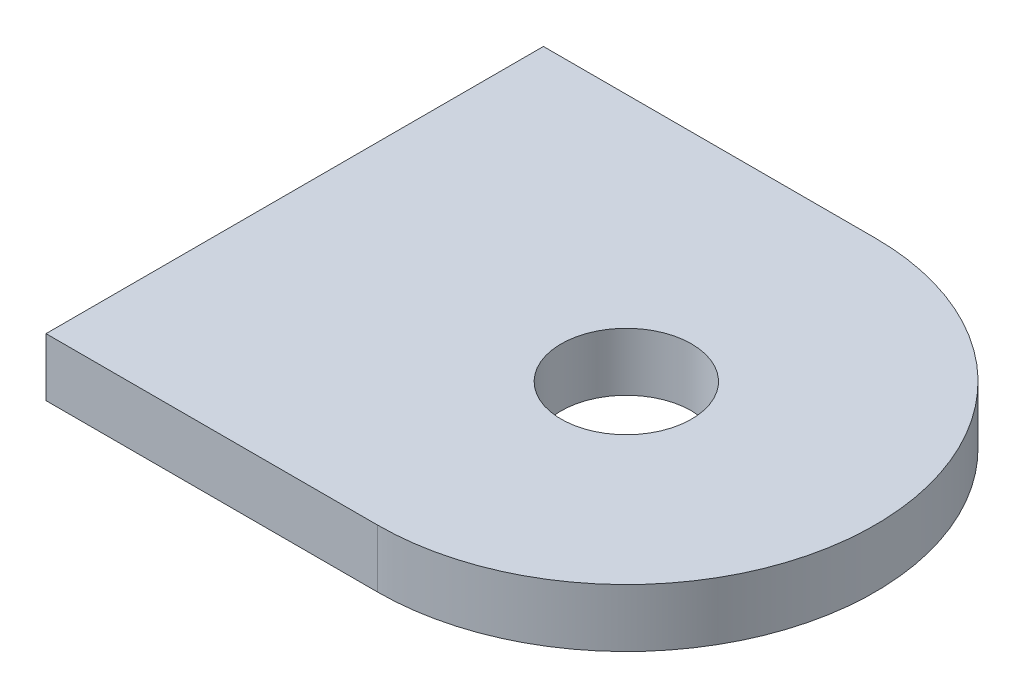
SolidWorks part; units mm, degrees
ref_plane "Front Plane" through (0, 0, 0) normal (0, 0, 1) x (1, 0, 0)
ref_plane "Top Plane" through (0, 0, 0) normal (0, 1, 0) x (1, 0, 0)
ref_plane "Right Plane" through (0, 0, 0) normal (1, 0, 0) x (0, 0, -1)
sketch "Sketch1"
  dimension "D1" = 76.2
  dimension "D2" = 50.8
extrude "Extrude1" add sketch "Sketch1" along normal blind 8.89
extrude "Cut-Extrude3" cut sketch "Sketch4" against normal blind 42.926
sketch "Sketch4"
  dimension "D1" = 9.99
